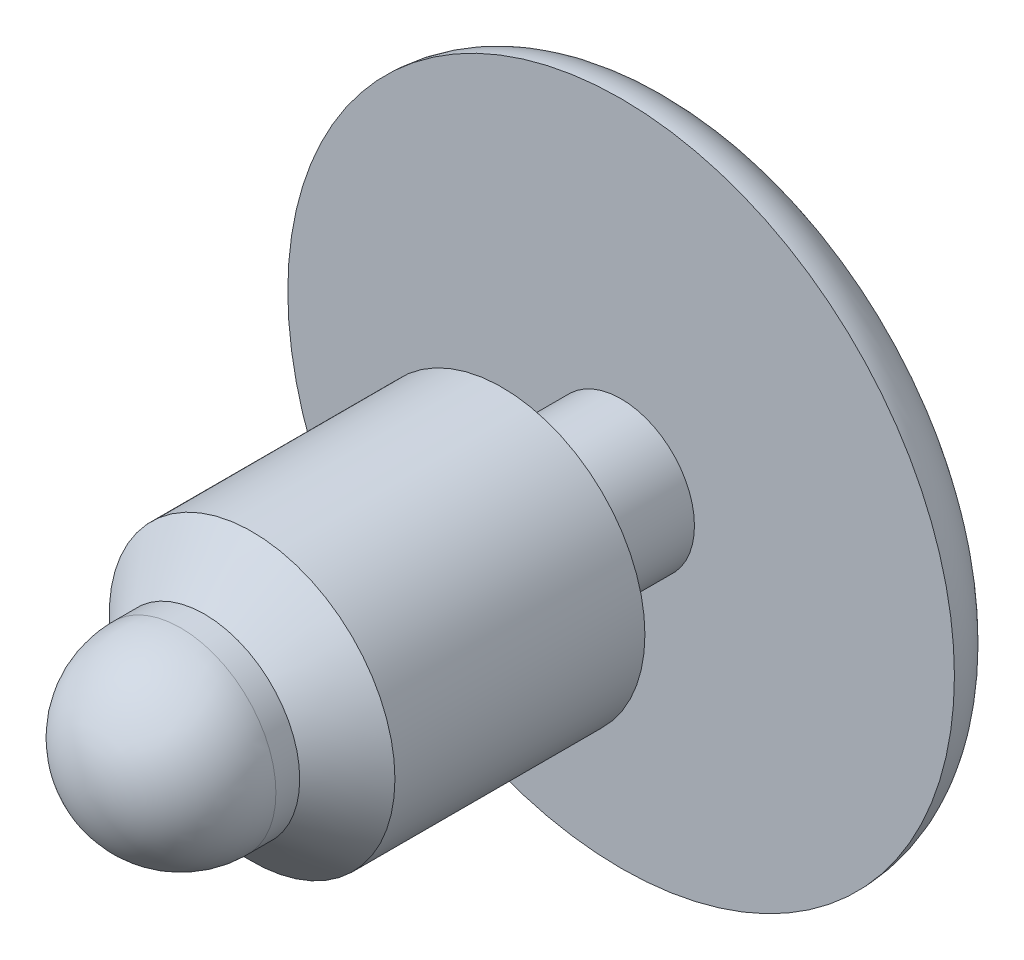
SolidWorks part; units mm, degrees
ref_plane "Front"
ref_plane "Top" through (0, 0, 0) normal (0, 1, 0) x (1, 0, 0)
ref_plane "Right" through (0, 0, 0) normal (1, 0, 0) x (0, 0, -1)
sketch "Sketch1" plane through (0, 0, 0) normal (0, 0, 1) x (1, 0, 0)
  circle A0 centre (0, 0) radius 8.89
  dimension "D1" = 17.78
extrude "Extrude1" add sketch "Sketch1" along normal blind 1.524
sketch "Sketch2" plane through (0, 0, 1.524) normal (0, 0, 1) x (1, 0, 0)
  circle A0 centre (0, 0) radius 1.9558
  dimension "D1" = 3.9116
extrude "Extrude2" add sketch "Sketch2" along normal blind 3.175
sketch "Sketch3" plane through (0, 0, 4.699) normal (0, 0, 1) x (1, 0, 0)
  circle A0 centre (0, 0) radius 3.81
  dimension "D1" = 7.62
extrude "Extrude3" add sketch "Sketch3" along normal blind 7.9375
sketch "Sketch4" plane through (0, 0, 12.6365) normal (0, 0, 1) x (1, 0, 0)
  circle A0 centre (0, 0) radius 2.54
  dimension "D1" = 5.08
extrude "Extrude4" add sketch "Sketch4" along normal blind 3.175
fillet "Fillet1" radius 2.54
chamfer "Chamfer4" distance 1.27 angle 45
fillet "Fillet2" radius 1.524
